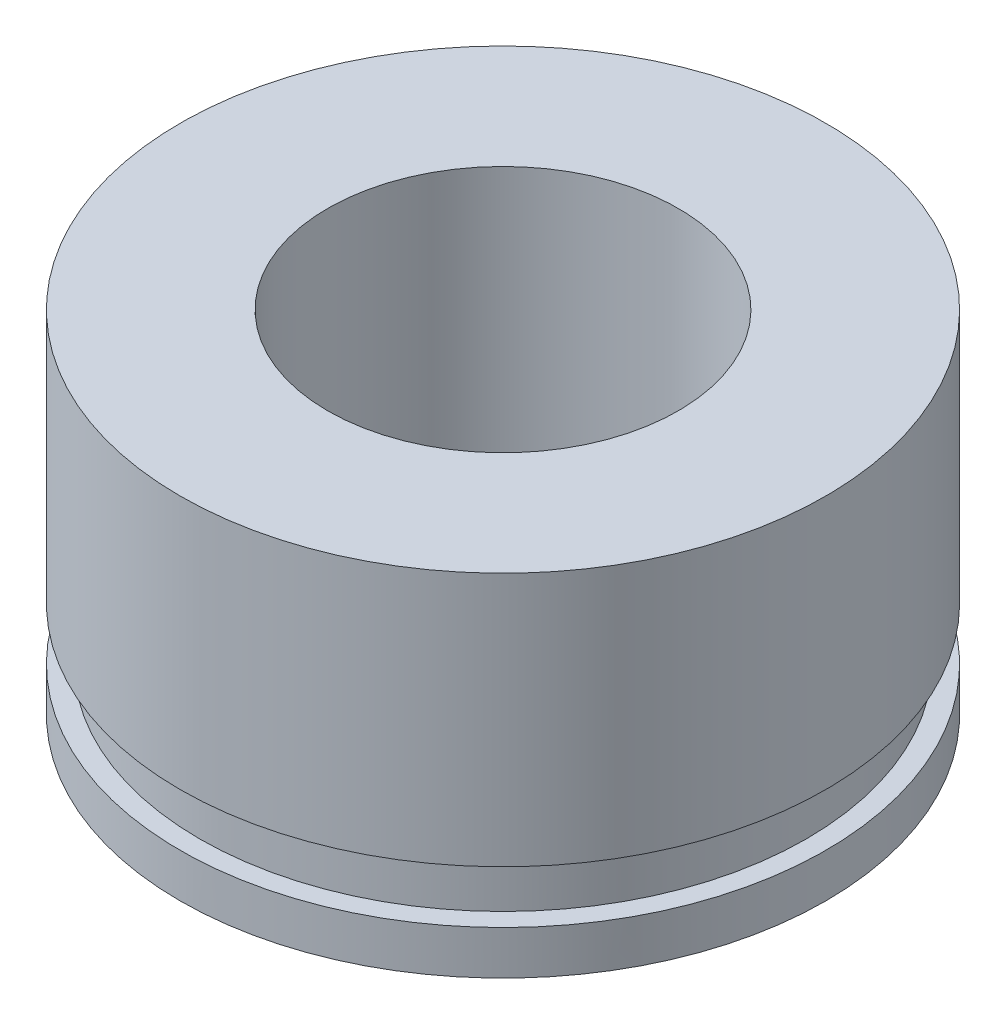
SolidWorks part; units mm, degrees
ref_plane "Front Plane" through (0, 0, 0) normal (0, 0, 1) x (1, 0, 0)
ref_plane "Top Plane" through (0, 0, 0) normal (0, 1, 0) x (1, 0, 0)
ref_plane "Right Plane" through (0, 0, 0) normal (1, 0, 0) x (0, 0, -1)
sketch "Sketch1" plane through (0, 0, 0) normal (0, 1, 0) x (1, 0, 0)
  circle A0 centre (0, 0) radius 18.415
  dimension "D1" = 36.83
extrude "Extrude1" add sketch "Sketch1" along normal blind 20
sketch "Sketch2" plane through (0, 20, 0) normal (0, 1, 0) x (-1, 0, 0)
  circle A0 centre (0, 0) radius 10
  dimension "D1" = 20
extrude "Cut-Extrude1" cut sketch "Sketch2" against normal through all
sketch "Sketch3" plane through (0, 0, 0) normal (1, 0, 0) x (0, 0, -1)
  line L0 (-18.415, 0) -> (18.415, 0) construction
  line L1 (19.0943, 5.5) -> (17.2957, 5.5)
  line L2 (19.0943, 5.5) -> (19.0943, 2.5)
  line L3 (19.0943, 2.5) -> (17.2957, 2.5)
  line L4 (17.2957, 5.5) -> (17.2957, 2.5)
  line L5 (0, 0) -> (0, 10.8784) construction
  dimension "D1" = 1.7986
  dimension "D2" = 2.5
  dimension "D3" = 3
revolve "Cut-Revolve1" cut sketch "Sketch3" angle 360 about L5
